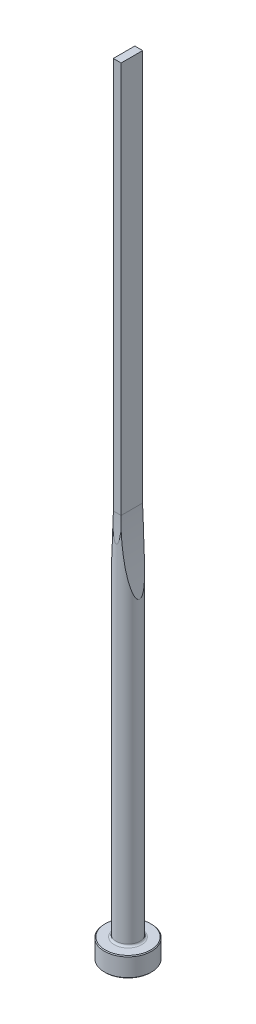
SolidWorks part; units mm, degrees
ref_plane "Front Plane" through (0, 0, 0) normal (0, 0, 1) x (1, 0, 0)
ref_plane "Top Plane" through (0, 0, 0) normal (0, 1, 0) x (1, 0, 0)
ref_plane "Right Plane" through (0, 0, 0) normal (1, 0, 0) x (0, 0, -1)
sketch "Sketch1" plane through (0, 0, 0) normal (0, 0, 1) x (1, 0, 0)
  line L0 (0, 0) -> (5.8, 0)
  line L1 (55, 0) -> (-55, 0) construction
  line L2 (6, 0.2) -> (6, 4.8)
  line L3 (5.8, 5) -> (3.5, 5)
  line L4 (3, 5.5) -> (3, 200)
  line L5 (0, 200) -> (3, 200)
  line L6 (6, 4.8) -> (5.8, 5)
  line L7 (5.8, 0) -> (6, 0.2)
  line L8 (0, 200) -> (0, 0)
  arc A0 (3, 5.5) -> (3.5, 5) centre (3.5, 5.5) ccw
  point P1 (6, 0)
  point P6 (6, 5)
  dimension "D4" = 0.5
  dimension "D1" = 3
  dimension "D2" = 6
  dimension "D3" = 5
  dimension "D5" = 200
revolve "Revolve1" add sketch "Sketch1" angle 360 about L8
sketch "Sketch2" plane through (0, 0, 0) normal (0, 0, 1) x (1, 0, 0)
  line L0 (1, 200) -> (1, 100)
  line L1 (3, 200) -> (-3, 200) construction
  line L2 (-1, 200) -> (-1, 100)
  line L3 (3, 200) -> (3, 81.132)
  line L4 (-3, 200) -> (-3, 81.132)
  line L5 (0, -6.6) -> (0, 6.6) construction
  line L6 (3, 200) -> (1, 200)
  line L8 (-1, 200) -> (-3, 200)
  arc A0 (1, 100) -> (3, 81.132) centre (91, 100) ccw
  arc A1 (-1, 100) -> (-3, 81.132) centre (-91, 100) cw
  dimension "D4" = 90
  dimension "D1" = 100
  dimension "D2" = 2
  dimension "D3" = 1
extrude "Cut-Extrude1" cut sketch "Sketch2" against normal mid plane 10
sketch "Sketch3" plane through (0, 0, 0) normal (1, 0, 0) x (0, 0, -1)
  line L0 (2.75, 200) -> (2.75, 100)
  line L1 (-2.8284, 200) -> (2.8284, 200) construction
  line L2 (-2.75, 200) -> (-2.75, 100)
  line L3 (3, 200) -> (3, 93.2965)
  line L4 (2.75, 200) -> (3, 200)
  line L5 (0, 6.6) -> (0, -6.6) construction
  line L6 (-3, 200) -> (-3, 93.2965)
  line L8 (-2.75, 200) -> (-3, 200)
  arc A0 (2.75, 100) -> (3, 93.2965) centre (92.75, 100) ccw
  arc A1 (-2.75, 100) -> (-3, 93.2965) centre (-92.75, 100) cw
  dimension "D2" = 90
  dimension "D1" = 100
  dimension "D3" = 5.5
  dimension "D4" = 2.75
extrude "Cut-Extrude2" cut sketch "Sketch3" against normal mid plane 10
